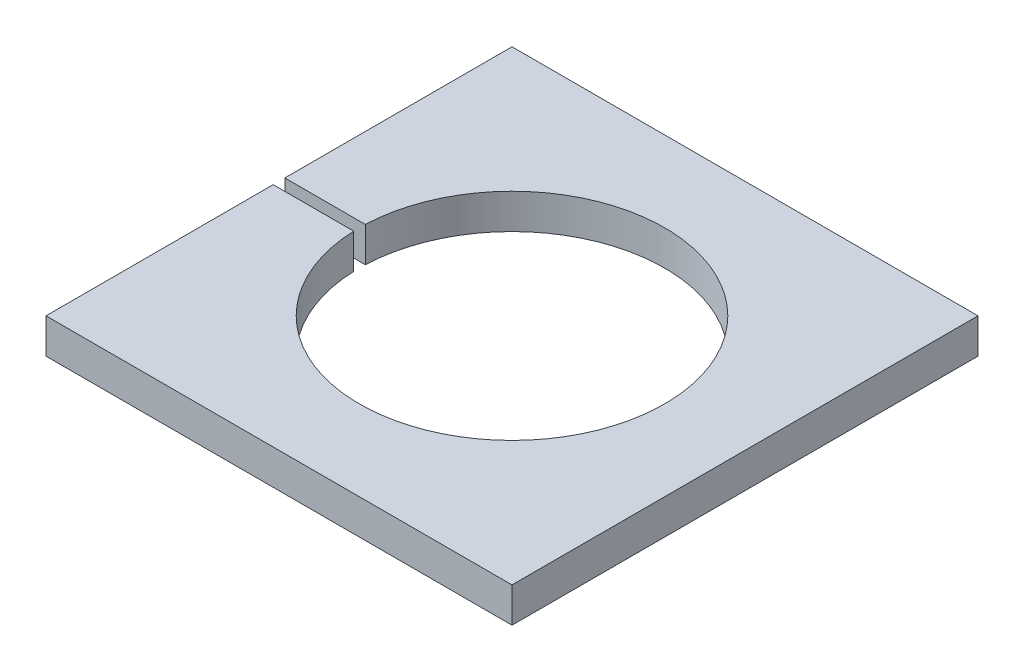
SolidWorks part; units mm, degrees
ref_plane "Plan de face" through (0, 0, 0) normal (0, 0, 1) x (1, 0, 0)
ref_plane "Plan de dessus" through (0, 0, 0) normal (0, 1, 0) x (1, 0, 0)
ref_plane "Plan de droite" through (0, 0, 0) normal (1, 0, 0) x (0, 0, -1)
sketch "Esquisse1" plane through (0, 0, 0) normal (0, 1, 0) x (1, 0, 0)
  line L1 (-40, 40) -> (40, 40)
  line L2 (-40, 40) -> (-40, -40)
  line L3 (-40, -40) -> (40, -40)
  line L4 (40, 40) -> (40, -40)
  circle A0 centre (0, 0) radius 26.2
  dimension "D5" = 52.4
  dimension "D1" = 80
  dimension "D2" = 80
  dimension "D3" = 40
  dimension "D4" = 40
extrude "Extrusion1" add sketch "Esquisse1" along normal blind 6
sketch "Esquisse2" plane through (0, 6, 0) normal (0, 1, 0) x (-1, 0, 0)
  line L0 (0, 0) -> (40, 0)
  line L1 (40, -40) -> (40, 40) construction
extrude "Enlèv. de mat.-Extru.-Mince1" cut sketch "Esquisse2" against normal through all thin
